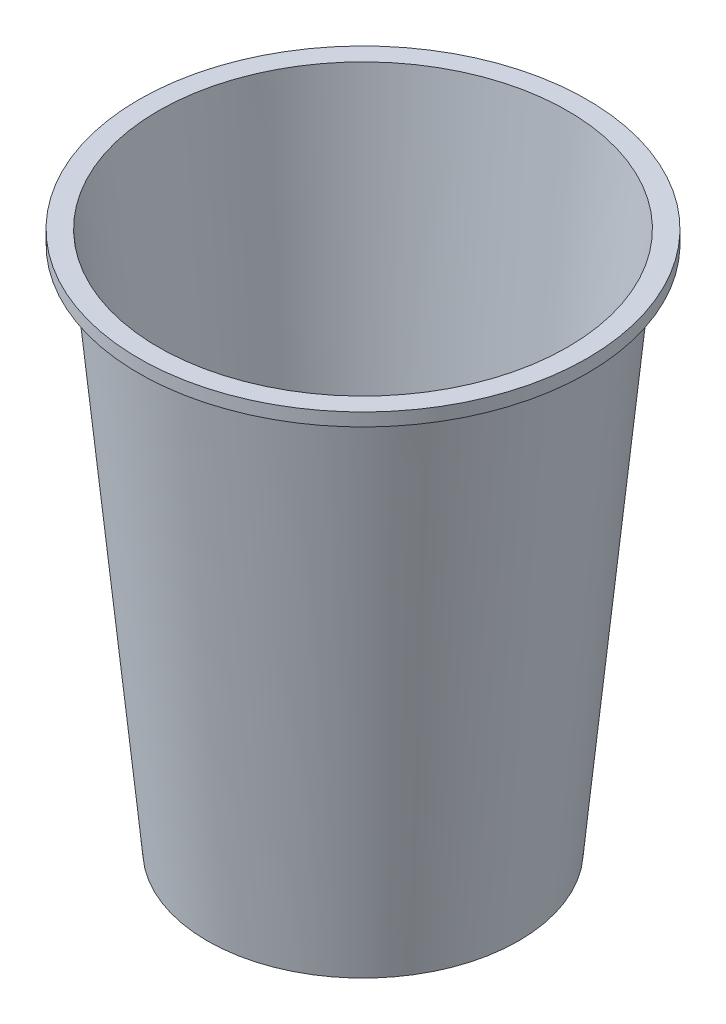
SolidWorks part; units mm, degrees
ref_plane "Front Plane" through (0, 0, 0) normal (0, 0, 1) x (1, 0, 0)
ref_plane "Top Plane" through (0, 0, 0) normal (0, 1, 0) x (1, 0, 0)
ref_plane "Right Plane" through (0, 0, 0) normal (1, 0, 0) x (0, 0, -1)
sketch "Sketch1" plane through (0, 0, 0) normal (0, 0, 1) x (1, 0, 0)
  line L0 (0, 0) -> (0, -89.0937) construction
  line L2 (31.75, -2) -> (24, -83)
  line L3 (24, -83) -> (0, -83)
  line L4 (0, -82.6) -> (0, -83)
  line L5 (31.5395, 0) -> (23.6364, -82.6)
  line L6 (23.6364, -82.6) -> (0, -82.6)
  line L7 (31.5013, -0.4) -> (23.6364, -82.6) construction
  line L8 (29, 22.8493) -> (29, -72.8031) construction
  line L9 (0, 0) -> (31.9414, 0) construction
  line L10 (0, -0.4) -> (31.5013, -0.4) construction
  line L11 (-43.464, -30.7419) -> (72.5801, -30.7419) construction
  line L13 (31.5395, 0) -> (34.5395, 0)
  line L14 (31.9414, 0) -> (24, -83) construction
  line L15 (31.75, -2) -> (34.5395, -2)
  line L16 (34.5395, 0) -> (34.5395, -2)
  point P19 (29, -30.7419)
  dimension "D1" = 83
  dimension "D2" = 63.5
  dimension "D3" = 48
  dimension "D5" = 52.2581
  dimension "D6" = 3
  dimension "D7" = 2
  dimension "D8" = 29
  dimension "D4" = 0.4
revolve "Revolve1" add sketch "Sketch1" angle 360 about L0
